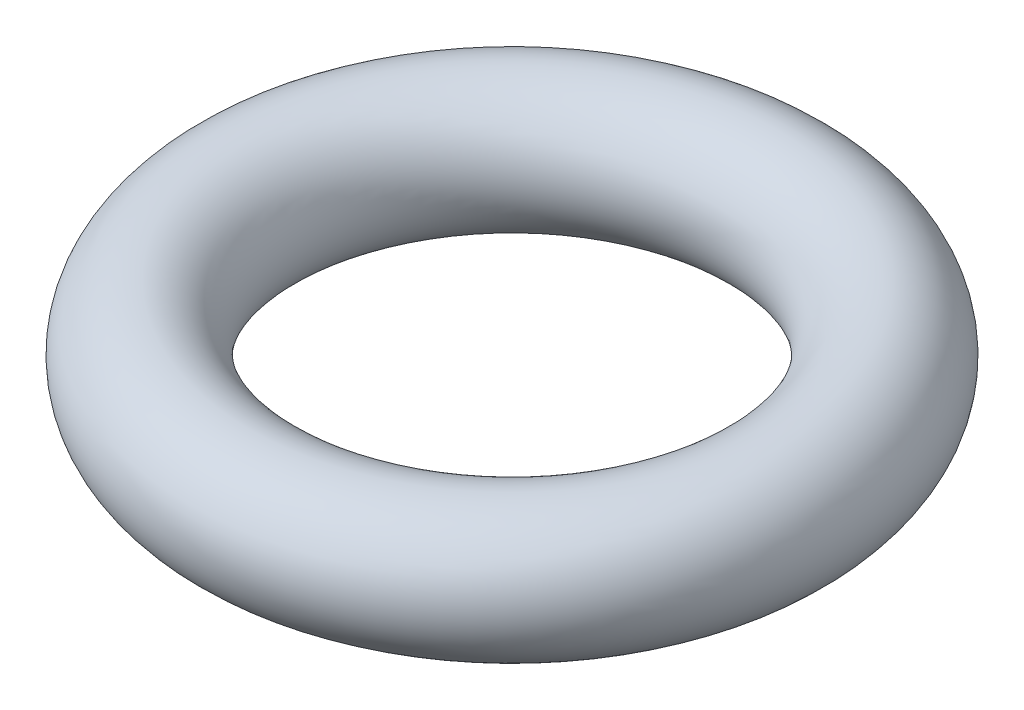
SolidWorks part; units mm, degrees
ref_plane "Front Plane" through (0, 0, 0) normal (0, 0, 1) x (1, 0, 0)
ref_plane "Top Plane" through (0, 0, 0) normal (0, 1, 0) x (1, 0, 0)
ref_plane "Right Plane" through (0, 0, 0) normal (1, 0, 0) x (0, 0, -1)
sketch "Sketch1" plane through (0, 0, 0) normal (0, 0, 1) x (1, 0, 0)
  line L0 (0, 0) -> (0, 1.1966) construction
  circle A0 centre (-3, 0) radius 0.75
  dimension "D1" = 1.5
  dimension "D2" = 3
revolve "Revolve1" add sketch "Sketch1" angle 360 about L0
